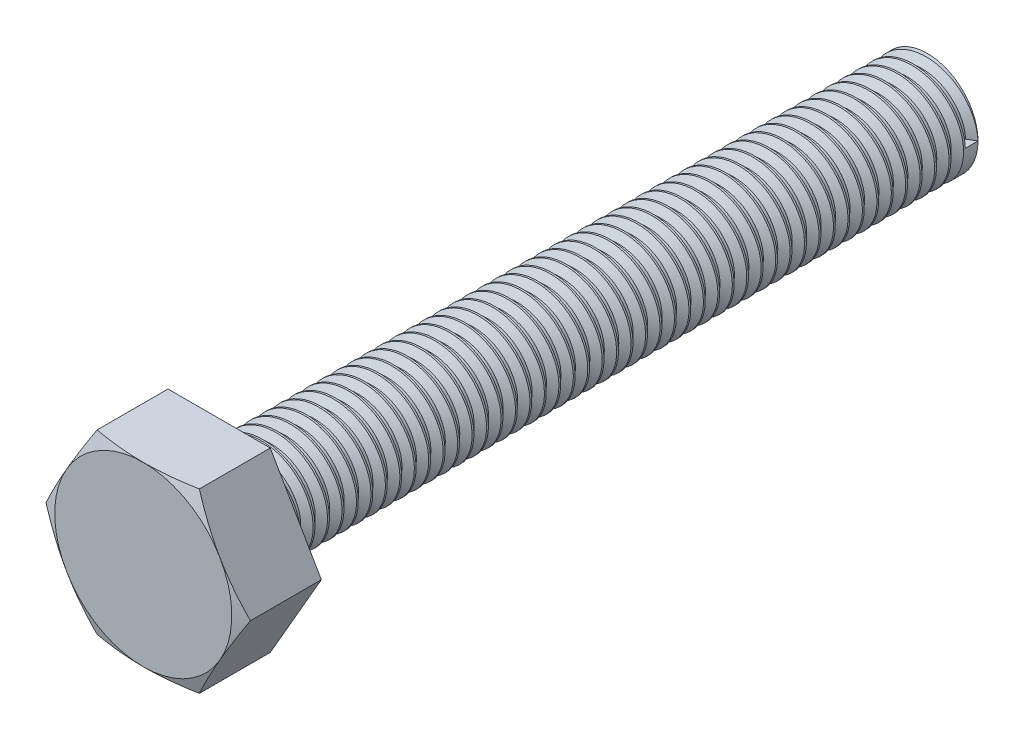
SolidWorks part; units mm, degrees
ref_plane "Front Plane" through (0, 0, 0) normal (0, 0, 1) x (1, 0, 0)
ref_plane "Top Plane" through (0, 0, 0) normal (0, 1, 0) x (1, 0, 0)
ref_plane "Right Plane" through (0, 0, 0) normal (1, 0, 0) x (0, 0, -1)
sketch "Sketch1" plane through (0, 0, 0) normal (0, 0, 1) x (1, 0, 0)
  circle A0 centre (0, 0) radius 3.175
  dimension "D1" = 6.35
extrude "Boss-Extrude1" add sketch "Sketch1" along normal blind 44.45
sketch "Sketch2" plane through (0, 0, 44.45) normal (0, 0, 1) x (1, 0, 0)
  line L1 (6.4158, 0) -> (3.2079, 5.5563)
  line L2 (3.2079, 5.5563) -> (-3.2079, 5.5563)
  line L3 (-3.2079, 5.5563) -> (-6.4158, 0)
  line L4 (-6.4158, 0) -> (-3.2079, -5.5563)
  line L5 (-3.2079, -5.5563) -> (3.2079, -5.5563)
  line L6 (3.2079, -5.5563) -> (6.4158, 0)
  circle A0 centre (0, 0) radius 5.5562 construction
  dimension "D1" = 11.1125
extrude "Boss-Extrude2" add sketch "Sketch2" along normal blind 4.7625
sketch "Sketch3" plane through (0, 0, 0) normal (1, 0, 0) x (0, 0, -1)
  line L3 (-49.2125, -5.5563) -> (-49.2125, -9.7774)
  line L4 (-49.2125, -9.7774) -> (-47.6761, -9.7774)
  line L5 (-47.6761, -9.7774) -> (-49.2125, -5.5563)
  line L6 (-49.2125, 0) -> (-50.2499, 0) construction
  dimension "D1" = 20
revolve "Cut-Revolve1" cut sketch "Sketch3" angle 360 about L6
thread "Thread1" pitch 0.9071 start angle 0, offset 0, length 43.02, pitch 0.9071, diameter 6.35
ref_plane "Plane1" through (3.175, 0, 0) normal (0, -1, 0) x (1, 0, 0)
sketch "Thread Profile1" plane through (3.175, 0, 0) normal (0, -1, 0) x (1, 0, 0)
  line L0 (0, 0) -> (0, 0.9071) construction
  line L11 (0, 0) -> (0, 0.7937)
  line L12 (0, 0.7937) -> (-0.491, 0.5103)
  line L13 (-0.491, 0.5103) -> (-0.491, 0.2835)
  line L15 (-0.491, 0.2835) -> (0, 0)
  line L17 (-0.491, 0.3969) -> (0, 0.3969) construction
  point P2 (0, 0)
  dimension "Pitch" = 0.9071
  dimension "Profile_Angle" = 60
  dimension "Profile_Land" = 0.2268
  dimension "Profile_Height" = 0.491
